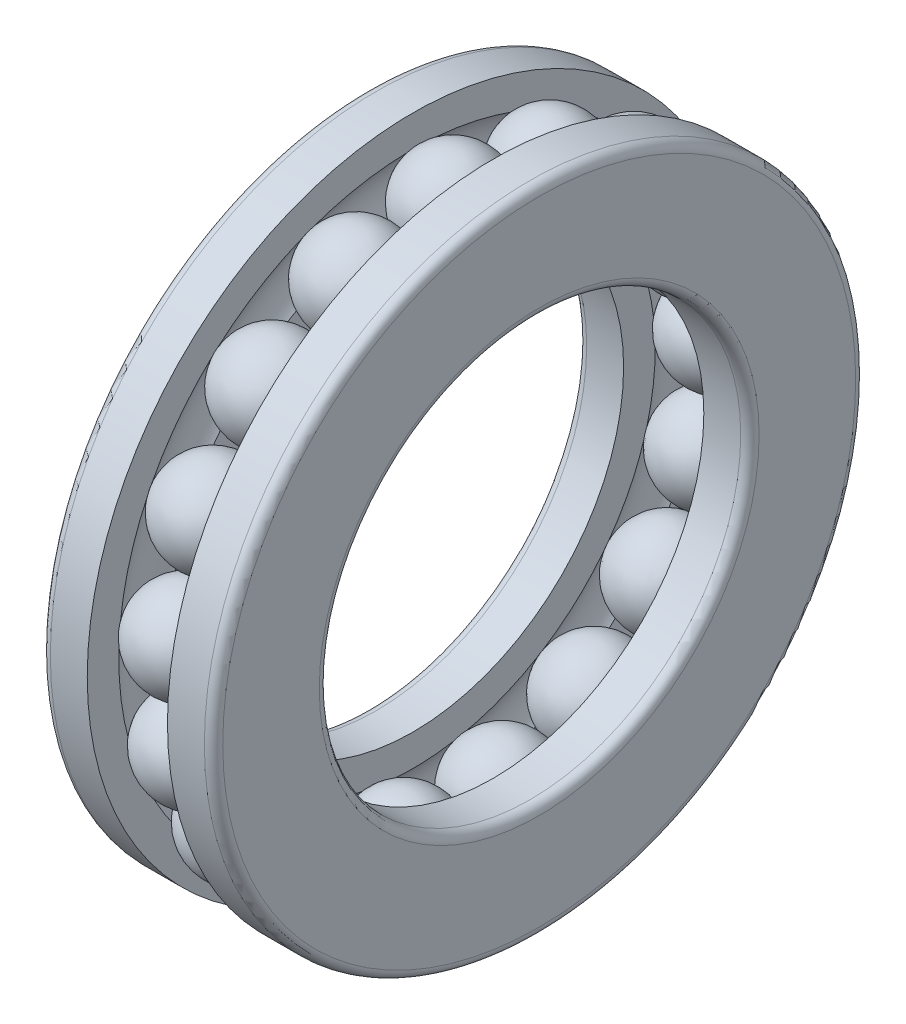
SolidWorks part; units mm, degrees
ref_plane "Plane1" through (0, 0, 0) normal (0, 0, 1) x (1, 0, 0)
ref_plane "Plane2" through (0, 0, 0) normal (0, 1, 0) x (1, 0, 0)
ref_plane "Plane3" through (0, 0, 0) normal (1, 0, 0) x (0, 0, -1)
other "Configuration Table"
sketch "Clipboard" plane through (0, 0, 0) normal (0, 0, 1) x (1, 0, 0)
  line L0 (-10, 0) -> (10, 0) construction
  line L1 (0, 0) -> (21.3836, -6.5376)
  line L2 (0, 0) -> (27.3662, 35.0271)
  line L3 (0, 0) -> (13.7666, -17.6205)
  line L4 (0, 0) -> (-22.3471, -0.7804)
sketch "InnRacSke" plane through (0, 0, 0) normal (0, 0, 1) x (1, 0, 0)
  line L0 (-6.6469, 40.1573) -> (-6.6469, 34.925)
  line L1 (-6.6469, 34.925) -> (-12.7635, 34.925)
  line L2 (-14.2875, 36.449) -> (-14.2875, 52.451)
  line L3 (-12.7635, 53.975) -> (-6.6469, 53.975)
  line L4 (-6.6469, 53.975) -> (-6.6469, 48.7427)
  line L5 (-34.925, 0) -> (34.925, 0) construction
  line L6 (0, 0) -> (0, 25.4) construction
  arc A0 (-12.7635, 34.925) -> (-14.2875, 36.449) centre (-12.7635, 36.449) cw
  arc A1 (-14.2875, 52.451) -> (-12.7635, 53.975) centre (-12.7635, 52.451) cw
  arc A2 (-6.6469, 48.7427) -> (-6.6469, 40.1573) centre (0, 44.45) ccw
revolve "Race" add sketch "InnRacSke" angle 360 about L5
ref_axis "Axis1" through (-50, 0, 0) along (1, 0, 0)
sketch "BalDetSke" plane through (0, 0, 0) normal (0, 0, 1) x (1, 0, 0)
  line L0 (-7.9375, 44.45) -> (7.9375, 44.45)
  line L1 (-14.5732, 44.45) -> (14.5732, 44.45) construction
  arc A0 (7.9375, 44.45) -> (-7.9375, 44.45) centre (0, 44.45) cw
revolve "BallDetailed" add sketch "BalDetSke" angle 360 about L1
sketch "BalSimSke" plane through (0, 0, 0) normal (0, 0, 1) x (1, 0, 0)
  line L0 (-25.4, 0) -> (25.4, 0) construction
  circle A0 centre (0, 44.45) radius 7.9375
revolve "BallsSimplified" [suppressed] add sketch "BalSimSke" angle 360 about L0
mirror "Mirror1" about plane through (0, 0, 0) normal (1, 0, 0) of "Race"
pattern_circular "BallsDetailed" count 17 every 21.176 about axis through (-50, 0, 0) along (1, 0, 0) of "BallDetailed"
sketch "CagSpiSke" plane through (0, 0, 0) normal (0, 0, 1) x (1, 0, 0)
  line L0 (1.9844, 35.7188) -> (1.9844, 53.1812)
  line L1 (1.9844, 53.1812) -> (-1.9844, 53.1812)
  line L2 (-1.9844, 53.1812) -> (-1.9844, 35.7188)
  line L3 (-1.9844, 35.7188) -> (1.9844, 35.7188)
  line L4 (-34.925, 0) -> (34.925, 0) construction
  line L5 (0, 0) -> (0, 50.8) construction
revolve "CageSpine" [suppressed] add sketch "CagSpiSke" angle 360 about L4
equation "\"BallCLRad@Clipboard\" =  ( \"OD@InnRacSke\" + \"ID@InnRacSke\" )  / 4"
equation "\"BallCLRad@BalSimSke\" =  \"BallCLRad@Clipboard\""
equation "\"BallCLRad@BalDetSke\" =  \"BallCLRad@Clipboard\""
equation "\"BallCLRad@InnRacSke\" =  \"BallCLRad@Clipboard\""
equation "\"Ball_diameter@InnRacSke\" =  \"Ball_diameter@BalDetSke\" - 0.05"
equation "\"Ball_diameter@BalSimSke\" =  \"Ball_diameter@BalDetSke\""
equation "\"Max_countClipboard_v1\" =  int( 3.14159265 / atn(( \"Ball_diameter@BalDetSke\" / 2) / sqr( \"BallCLRad@Clipboard\"  *  \"BallCLRad@Clipboard\" - ( \"Ball_diameter@BalDetSke\" / 2) *  ( \"Ball_diameter@BalDetSk"
equation "\"Max_count@Clipboard\" =  ((sgn( \"Max_countClipboard_v1\" - \"Count@Clipboard\" )-1)*( \"Max_countClipboard_v1\" - \"Count@Clipboard\" ))/-2+ \"Count@Clipboard\""
equation "\"CountBallsDetailed_v1\" =  int( \"Show_count@Clipboard\" )"
equation "\"CountBallsDetailed_v2\" =  ((sgn( \"CountBallsDetailed_v1\" - \"Max_count@Clipboard\" )-1)*( \"CountBallsDetailed_v1\" - \"Max_count@Clipboard\" ))/-2+ \"Max_count@Clipboard\""
equation "\"Count@BallsDetailed\" =  ((sgn( \"CountBallsDetailed_v2\" - \"Min_count@Clipboard\" )+1)*( \"CountBallsDetailed_v2\" - \"Min_count@Clipboard\"))/2 +\"Min_count@Clipboard\""
equation "\"Angle@BallsDetailed\" =  360.0 / \"Max_count@Clipboard\""
equation "\"AngleCageSpine_v1\" =  \"Angle@BallsDetailed\" * ( \"Count@BallsDetailed\" -1 + int( \"Count@BallsDetailed\" / \"Max_count@Clipboard\" ) )  + 0.001 -  int( \"Count@BallsDetailed\" / \"Max_count@Clipboard\" ) * 0."
equation "\"Angle@CageSpine\" =  \"AngleCageSpine_v1\" * int( \"Min_count@Clipboard\" / 2) + int(1 / \"Min_count@Clipboard\")  * 0.001"
equation "\"Thickness@CagSpiSke\" =  \"Ball_diameter@BalDetSke\" * 0.25"
equation "\"OD@CagSpiSke\" =  ( \"OD@InnRacSke\" + ( \"BallCLRad@Clipboard\" * 2 + \"Ball_diameter@BalDetSke\" )) / 2"
equation "\"ID@CagSpiSke\" =  ( \"ID@InnRacSke\" + ( \"BallCLRad@Clipboard\" * 2 - \"Ball_diameter@BalDetSke\" )) / 2"
